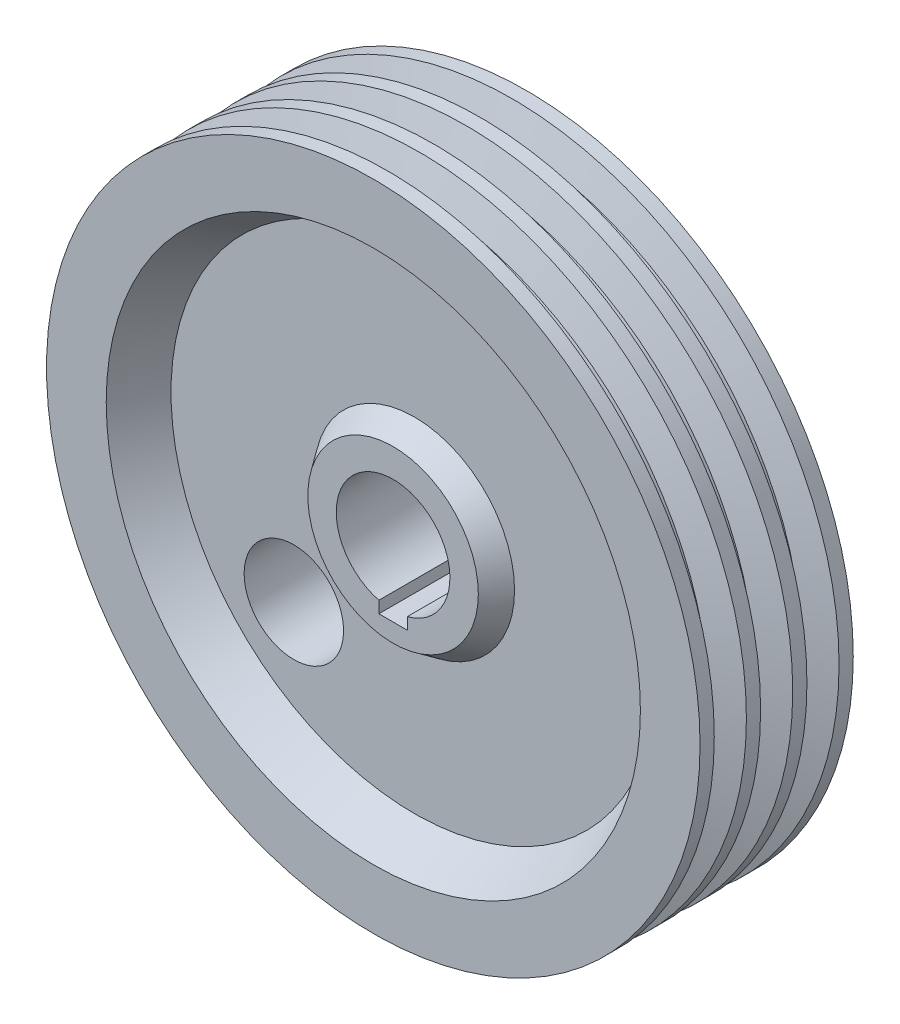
SolidWorks part; units mm, degrees
ref_plane "Front" through (0, 0, 0) normal (0, 0, 1) x (1, 0, 0)
ref_plane "Top" through (0, 0, 0) normal (0, 1, 0) x (1, 0, 0)
ref_plane "Right" through (0, 0, 0) normal (1, 0, 0) x (0, 0, -1)
sketch "Sketch1" plane through (0, 0, 0) normal (0, -1, 0) x (0, 0, -1)
  line L0 (-65.6422, 0) -> (63.772, 0) construction
  line L1 (0, 0) -> (0, 112.4085) construction
  line L2 (26.959, 115) -> (26.959, 94)
  line L3 (26.959, 115) -> (21.959, 115)
  line L4 (21.959, 115) -> (18.806, 105)
  line L5 (18.806, 105) -> (13.806, 105)
  line L6 (13.806, 105) -> (10.653, 115)
  line L7 (10.653, 115) -> (5.653, 115)
  line L8 (5.653, 115) -> (2.5, 105)
  line L9 (2.5, 105) -> (-2.5, 105)
  line L10 (26.959, 94) -> (12.5, 85.6521)
  line L11 (12.5, 85.6521) -> (12.5, 35.2516)
  line L12 (12.5, 35.2516) -> (20, 30)
  line L13 (20, 30) -> (20, 0)
  line L14 (-20, 30) -> (-20, 0)
  line L15 (-12.5, 35.2516) -> (-20, 30)
  line L16 (-12.5, 85.6521) -> (-12.5, 35.2516)
  line L17 (-26.959, 94) -> (-12.5, 85.6521)
  line L18 (-5.653, 115) -> (-2.5, 105)
  line L19 (-10.653, 115) -> (-5.653, 115)
  line L20 (-13.806, 105) -> (-10.653, 115)
  line L21 (-18.806, 105) -> (-13.806, 105)
  line L22 (-21.959, 115) -> (-18.806, 105)
  line L23 (-26.959, 115) -> (-21.959, 115)
  line L24 (-26.959, 115) -> (-26.959, 94)
  line L25 (-20, 0) -> (20, 0)
  point P24 (0, 105)
  dimension "D1" = 5
  dimension "D2" = 10
  dimension "D3" = 35
  dimension "D4" = 230
  dimension "D5" = 120
  dimension "D6" = 25
  dimension "D7" = 60
  dimension "D8" = 125
  dimension "D9" = 40
  dimension "D10" = 21
revolve "Revolve1" add sketch "Sketch1" angle 360 about L0
other "Hole1"
sketch "Sketch2" plane through (0, 0, -20) normal (0, 0, -1) x (-1, 0, 0)
  circle A0 centre (0, 0) radius 20
  circle A1 centre (0, 0) radius 30 construction
  dimension "D1" = 40
sketch "Sketch3" plane through (0, 0, -20) normal (0, 0, -1) x (-1, 0, 0)
  line L0 (0, 0) -> (0, -32.5647) construction
  line L1 (5, -23.5) -> (-5, -23.5)
  line L2 (-5, -23.5) -> (-5, -19.3649)
  line L3 (5, -23.5) -> (5, -19.3649)
  circle A0 centre (0, 0) radius 20 construction
  arc A1 (-5, -19.3649) -> (5, -19.3649) centre (0, 0) ccw
  point P6 (0, -23.5)
  dimension "D1" = 10
  dimension "D2" = 3.5
extrude "Cut-Extrude1" cut sketch "Sketch3" against normal through all
sketch "Sketch4" plane through (0, 0, -12.5) normal (0, 0, -1) x (-1, 0, 0)
  line L0 (0, 0) -> (61.6713, 0) construction
  line L1 (0, 0) -> (42.4264, -42.4264) construction
  circle A0 centre (42.4264, -42.4264) radius 17.5
  dimension "D1" = 35
  dimension "D2" = 60
  dimension "D3" = 45
extrude "Cut-Extrude2" cut sketch "Sketch4" against normal through all
